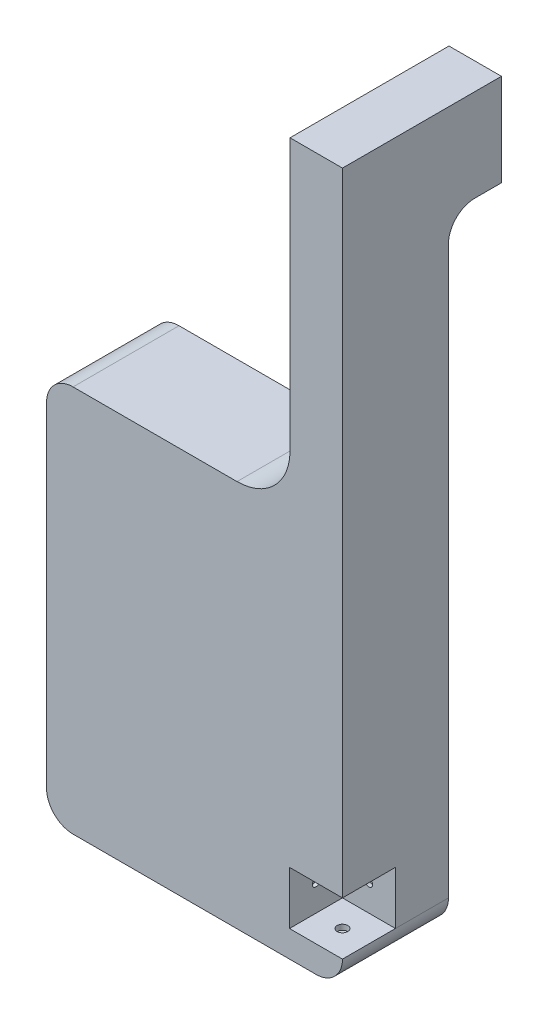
SolidWorks part; units mm, degrees
ref_plane "Front Plane" through (0, 0, 0) normal (0, 0, 1) x (1, 0, 0)
ref_plane "Top Plane" through (0, 0, 0) normal (0, 1, 0) x (1, 0, 0)
ref_plane "Right Plane" through (0, 0, 0) normal (1, 0, 0) x (0, 0, -1)
sketch "Sketch1" plane through (0, 0, 0) normal (0, 0, 1) x (1, 0, 0)
  line L0 (4.2038, 20.5585) -> (4.2038, 23.4755)
  line L1 (4.2038, 23.4755) -> (6.7182, 23.4755)
  line L2 (6.7182, 23.4755) -> (6.7182, -9.3624)
  line L4 (-7.4657, -9.3624) -> (-7.4657, 6.6636)
  line L5 (-6.1957, 7.9336) -> (1.6638, 7.9336)
  line L6 (4.2038, 10.4736) -> (4.2038, 20.5585)
  line L7 (-7.4657, -6.8364) -> (6.7182, -6.8364) construction
  line L8 (-7.4657, -10.6324) -> (6.7182, -10.6324) construction
  line L9 (2.9709, -6.8364) -> (2.9709, -8.8805) construction
  line L11 (-6.1957, -10.6324) -> (5.4482, -10.6324)
  arc A0 (1.6638, 7.9336) -> (4.2038, 10.4736) centre (1.6638, 10.4736) ccw
  arc A1 (5.4482, -10.6324) -> (6.7182, -9.3624) centre (5.4482, -9.3624) ccw
  arc A2 (-6.1957, -10.6324) -> (-7.4657, -9.3624) centre (-6.1957, -9.3624) cw
  arc A3 (-6.1957, 7.9336) -> (-7.4657, 6.6636) centre (-6.1957, 6.6636) ccw
  dimension "D1" = 2.54
  dimension "D2" = 1.27
extrude "Boss-Extrude1" add sketch "Sketch1" along normal blind 5.08
sketch "Sketch2" plane through (0, 0, 0) normal (0, 0, -1) x (-1, 0, 0)
  line L0 (-4.2038, 23.4755) -> (-4.2038, 10.4736) construction
  line L1 (-6.7182, 23.4755) -> (-4.2038, 23.4755)
  line L2 (-6.7182, 23.4755) -> (-6.7182, 19.052)
  line L3 (-6.7182, 19.052) -> (-4.2038, 19.052)
  line L4 (-4.2038, 23.4755) -> (-4.2038, 19.052)
extrude "Boss-Extrude2" add sketch "Sketch2" along normal blind 2.54
fillet "Fillet1" radius 1.27 1 edges
sketch "Sketch3" plane through (0, 0, 5.08) normal (0, 0, 1) x (1, 0, 0)
  line L1 (6.7182, -9.3624) -> (4.1782, -9.3624)
  line L2 (6.7182, -9.3624) -> (6.7182, -6.8224)
  line L4 (6.7182, -6.8224) -> (4.1782, -6.8224)
  line L5 (4.1782, -9.3624) -> (4.1782, -6.8224)
  dimension "D1" = 2.54
extrude "Cut-Extrude5" cut sketch "Sketch3" against normal blind 2.54
sketch "Sketch7" plane through (0, -6.8224, 0) normal (0, -1, 0) x (1, 0, 0)
  circle A0 centre (5.4482, 3.81) radius 0.254
extrude "Cut-Extrude6" cut sketch "Sketch7" against normal blind 0.254
sketch "Sketch8" plane through (0, -9.3624, 0) normal (0, 1, 0) x (1, 0, 0)
  circle A0 centre (5.4482, -3.81) radius 0.254
extrude "Cut-Extrude7" cut sketch "Sketch8" against normal blind 0.254
sketch "Sketch9" plane through (4.1782, 0, 0) normal (1, 0, 0) x (0, 0, -1)
  circle A0 centre (-3.81, -8.0924) radius 0.1778
extrude "Cut-Extrude8" cut sketch "Sketch9" against normal blind 0.1778
sketch "Sketch10" plane through (0, 0, 2.54) normal (0, 0, 1) x (1, 0, 0)
  circle A0 centre (5.4482, -8.0924) radius 0.1778
extrude "Cut-Extrude9" cut sketch "Sketch10" against normal blind 0.1778
